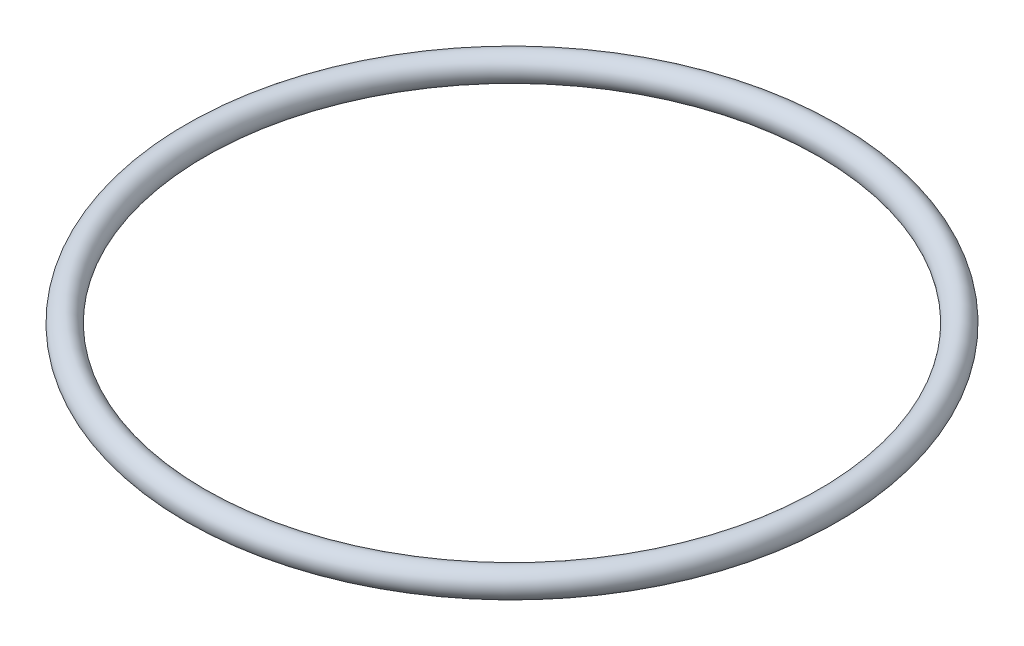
SolidWorks part; units mm, degrees
ref_plane "Front Plane" through (0, 0, 0) normal (0, 0, 1) x (1, 0, 0)
ref_plane "Top Plane" through (0, 0, 0) normal (0, 1, 0) x (1, 0, 0)
ref_plane "Right Plane" through (0, 0, 0) normal (1, 0, 0) x (0, 0, -1)
sketch "Sketch1" plane through (0, 0, 0) normal (0, 0, 1) x (1, 0, 0)
  line L0 (0, 0) -> (0, 21.0682) construction
  line L1 (0, 0) -> (31.3055, 0) construction
  circle A0 centre (31.3055, 0) radius 1.3081
  point P5 (29.9974, 0)
  dimension "D2" = 2.6162
  dimension "D1" = 59.9948
revolve "Revolve1" add sketch "Sketch1" angle 360 about L0
